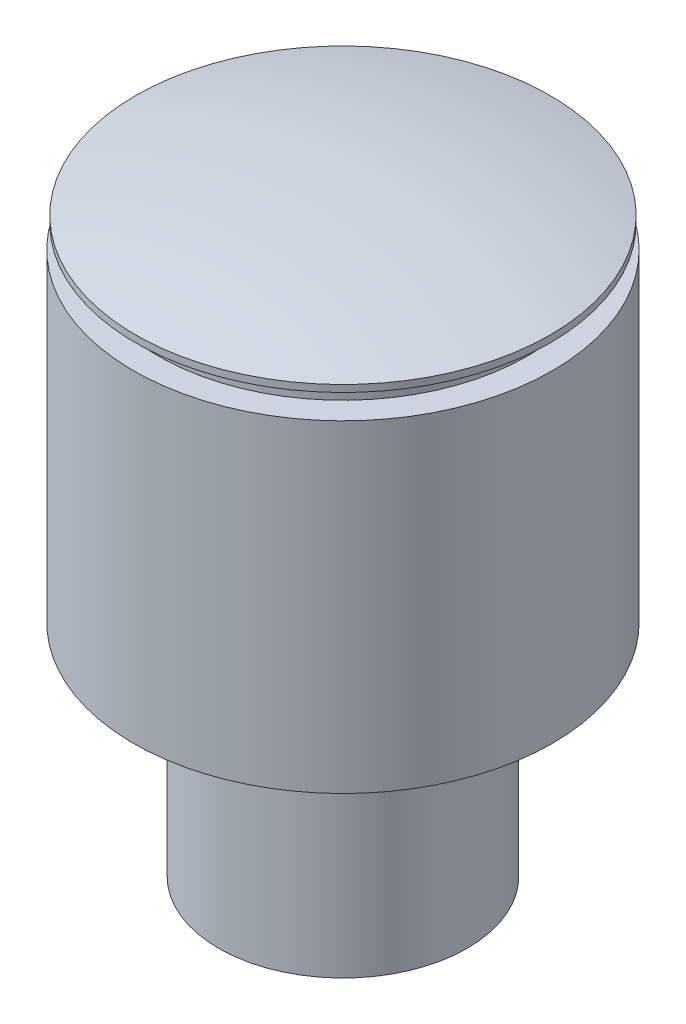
SolidWorks part; units mm, degrees
ref_plane "Front" through (0, 0, 0) normal (0, 0, 1) x (1, 0, 0)
ref_plane "Top" through (0, 0, 0) normal (0, 1, 0) x (1, 0, 0)
ref_plane "Right" through (0, 0, 0) normal (1, 0, 0) x (0, 0, -1)
sketch "Sketch1" plane through (0, 0, 0) normal (0, 0, 1) x (1, 0, 0)
  line L0 (0, -1000) -> (0, 49000) construction
  line L1 (0, 0) -> (5.3975, 0)
  line L2 (5.3975, 0) -> (5.3975, 9.5504)
  line L3 (5.3975, 9.5504) -> (9.0924, 9.5504)
  line L4 (8, 24.5618) -> (8, 23.5618)
  line L5 (8, 24.5618) -> (9, 24.5618)
  line L6 (9, 24.5618) -> (9, 24.8618)
  line L13 (0, 26.0049) -> (0, 0)
  line L14 (8, 23.5618) -> (9.0924, 23.5618)
  line L15 (9.0924, 23.5618) -> (9.0924, 9.5504)
  arc A0 (0, 26.0049) -> (9, 24.8618) centre (0, -9.9951) cw
  dimension "D6" = 36
  dimension "D1" = 10.795
  dimension "D2" = 16
  dimension "D3" = 15.0114
  dimension "D4" = 24.5618
  dimension "D5" = 0.3
  dimension "D7" = 18
  dimension "D13" = 1
revolve "Revolve1" add sketch "Sketch1" angle 360 mid plane about L0
